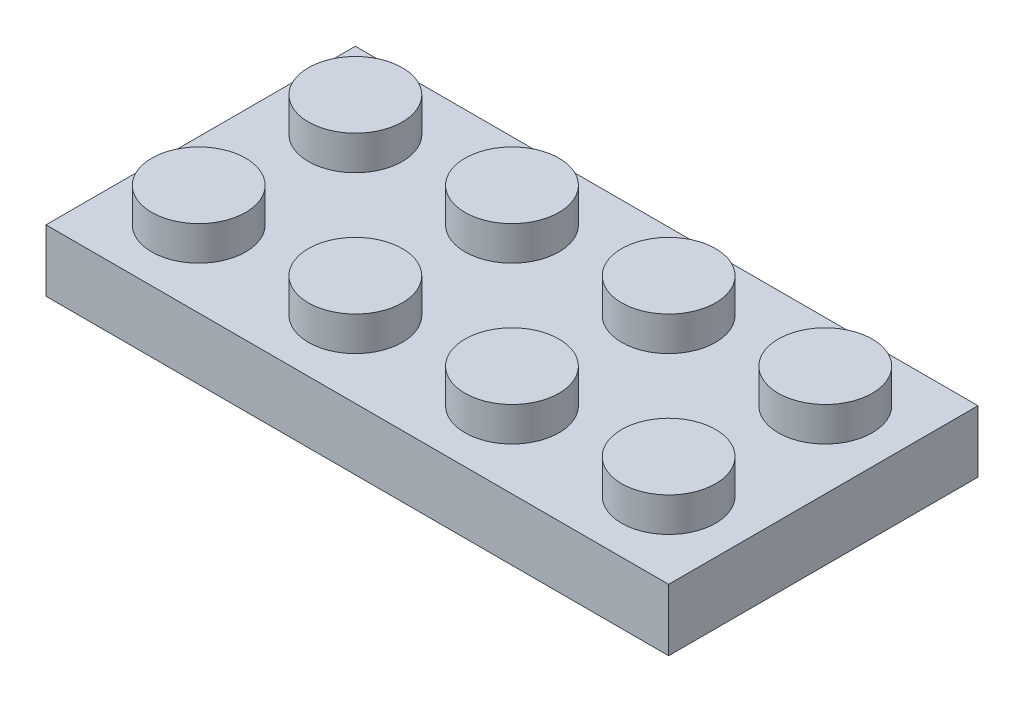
SolidWorks part; units mm, degrees
ref_plane "Front Plane" through (0, 0, 0) normal (0, 0, 1) x (1, 0, 0)
ref_plane "Top Plane" through (0, 0, 0) normal (0, 1, 0) x (1, 0, 0)
ref_plane "Right Plane" through (0, 0, 0) normal (1, 0, 0) x (0, 0, -1)
sketch "Sketch1" plane through (0, 0, 0) normal (0, 1, 0) x (1, 0, 0)
  line L1 (15.9, -7.9) -> (-15.9, -7.9)
  line L2 (15.9, -7.9) -> (15.9, 7.9)
  line L3 (15.9, 7.9) -> (-15.9, 7.9)
  line L4 (-15.9, -7.9) -> (-15.9, 7.9)
  line L5 (15.9, -7.9) -> (-15.9, 7.9) construction
  line L6 (15.9, 7.9) -> (-15.9, -7.9) construction
  point P0 (0, 0)
  dimension "D1" = 15.8
  dimension "D2" = 31.8
extrude "Extrude1" add sketch "Sketch1" along normal blind 3.16
sketch "Sketch2" plane through (0, 3.16, 0) normal (0, 1, 0) x (1, 0, 0)
  line L0 (12, -4) -> (12, -3.4252) construction
  circle A0 centre (12, 4) radius 2.4
  circle A1 centre (12, -4) radius 2.4
  dimension "D1" = 4.8
  dimension "D2" = 4.8
extrude "Extrude2" add sketch "Sketch2" along normal blind 1.75
sketch "Sketch3" plane through (0, 3.16, 0) normal (0, 1, 0) x (-1, 0, 0)
  line L0 (17.1927, 0) -> (-18.4099, 0) construction
sketch "Sketch4" plane through (0, 3.16, 0) normal (0, 1, 0) x (1, 0, 0)
  line L2 (-17.1927, 0) -> (18.4099, 0) construction
  line L3 (15.9, -7.9) -> (15.9, 7.9) construction
  circle A0 centre (7.9, 0) radius 2.4
  dimension "D1" = 8
  dimension "D2" = 4.8
sketch "Sketch5" plane through (0, 0, 0) normal (0, -1, 0) x (1, 0, 0)
  line L0 (-15.9, 7.9) -> (15.9, 7.9) construction
  line L1 (15.4, -7.4) -> (-15.4, -7.4)
  line L2 (15.4, -7.4) -> (15.4, 7.4)
  line L3 (15.4, 7.4) -> (-15.4, 7.4)
  line L4 (-15.4, -7.4) -> (-15.4, 7.4)
  line L5 (15.4, -7.4) -> (-15.4, 7.4) construction
  line L6 (15.4, 7.4) -> (-15.4, -7.4) construction
  line L7 (15.9, 7.9) -> (15.9, -7.9) construction
  point P0 (0, 0)
  dimension "D1" = 0.5
  dimension "D2" = 0.5
extrude "Extrude4" cut sketch "Sketch5" against normal blind 2.5
sketch "Sketch6" plane through (0, 2.5, 0) normal (0, -1, 0) x (1, 0, 0)
  line L0 (0, 0) -> (20.059, 0) construction
  line L1 (15.9, 7.9) -> (15.9, -7.9) construction
  circle A0 centre (7.9, 0) radius 3.4
  dimension "D1" = 6.8
  dimension "D2" = 8
extrude "Extrude5" add sketch "Sketch6" along normal blind 2.5
sketch "Sketch8" plane through (0, 3.16, 0) normal (0, 1, 0) x (1, 0, 0)
  line L0 (-10.2073, 0) -> (17.0459, 0) construction
pattern_linear "LPattern1" count 4 spacing 8 along (-1, 0, 0) of "Extrude2"
pattern_linear "LPattern3" count 3 spacing 8 along (-1, 0, 0) of "Extrude5"
